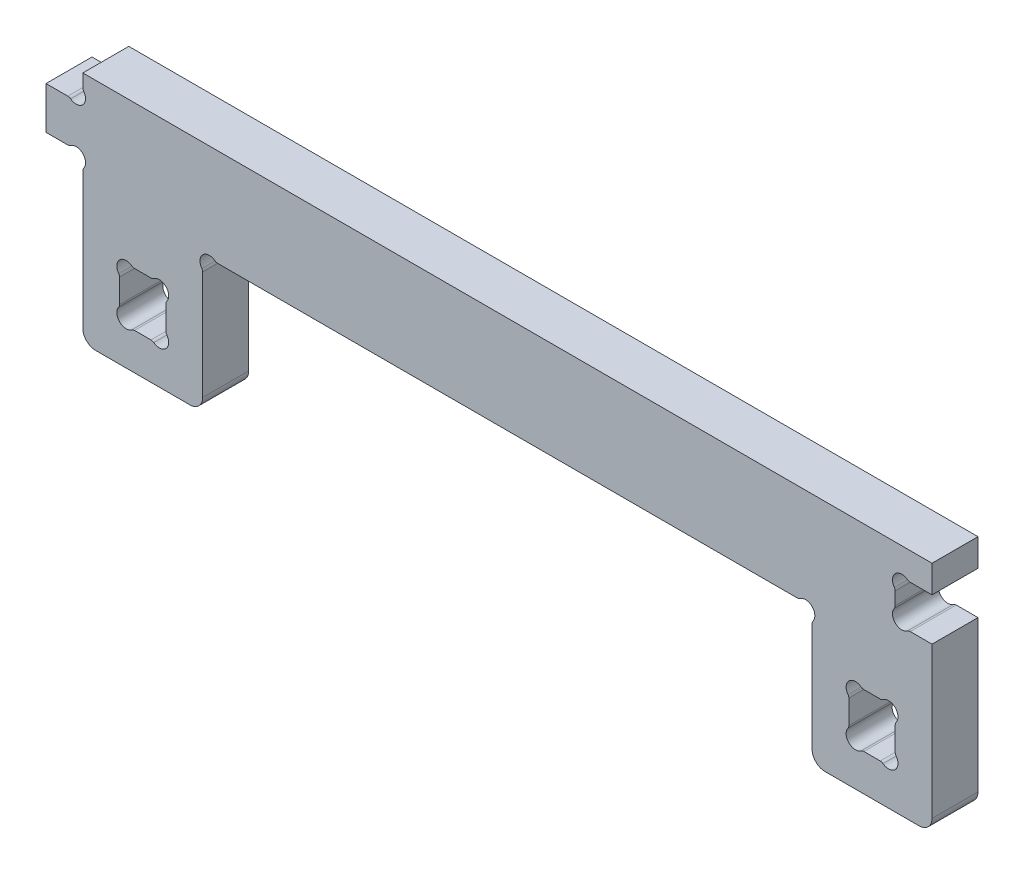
SolidWorks part; units mm, degrees
ref_plane "Plan de face" through (0, 0, 0) normal (0, 0, 1) x (1, 0, 0)
ref_plane "Plan de dessus" through (0, 0, 0) normal (0, 1, 0) x (1, 0, 0)
ref_plane "Plan de droite" through (0, 0, 0) normal (1, 0, 0) x (0, 0, -1)
sketch "Esquisse2" plane through (0, 0, 0) normal (0, 0, 1) x (1, 0, 0)
  line L0 (0, 74.1667) -> (-3.6062, 70.5604) construction
  line L1 (0, 0) -> (65.2, 0)
  line L2 (0, 0) -> (0, 66.0356)
  line L3 (-396.4431, 100.6667) -> (45.2, 100.6667) construction
  line L4 (45.3, 112.1667) -> (45.3, 89.1667) construction
  line L5 (65.2, 89.0667) -> (53.331, 89.0667)
  line L6 (65.2, 112.2667) -> (53.331, 112.2667)
  line L7 (-8.131, 74.1667) -> (-323.112, 74.1667)
  line L8 (-165.6215, 127.1667) -> (-165.6215, 74.1667) construction
  line L9 (-396.4431, 127.1667) -> (65.2, 127.1667)
  line L10 (45.2, 97.1977) -> (45.2, 104.1356)
  line L11 (45.2, 89.0667) -> (48.8062, 92.6729) construction
  line L12 (65.2, 127.1667) -> (65.2, 112.2667)
  line L13 (65.2, 89.0667) -> (65.2, 0)
  line L14 (-331.2431, 0) -> (-331.2431, 66.0356)
  line L15 (-331.2431, 0) -> (-396.4431, 0)
  line L16 (-396.4431, 81.0356) -> (-396.4431, 0)
  line L17 (-404.5741, 89.1667) -> (-416.4431, 89.1667)
  line L18 (-416.4431, 89.1667) -> (-416.4431, 112.1667)
  line L19 (-396.4431, 89.1667) -> (-400.0493, 85.5604) construction
  line L20 (-404.5741, 112.1667) -> (-416.4431, 112.1667)
  line L21 (45.2, 100.6667) -> (65.2, 100.6667) construction
  line L22 (-396.4431, 100.6667) -> (-416.4431, 100.6667) construction
  line L23 (-396.4431, 127.1667) -> (-396.4431, 120.2977)
  line L24 (45.3, 112.1667) -> (65.2, 112.1667) construction
  line L25 (-396.4431, 7) -> (-396.4431, 89.0667) construction
  line L26 (45.3, 89.1667) -> (65.2, 89.1667) construction
  line L28 (32.6, 32.6) -> (32.6, 20) construction
  line L29 (45.2, 41.0356) -> (45.2, 28.131)
  line L30 (28.131, 49.1667) -> (37.069, 49.1667)
  line L31 (20, 34.5833) -> (45.2, 34.5833) construction
  line L32 (20, 41.0356) -> (20, 28.131)
  line L33 (28.131, 20) -> (37.069, 20)
  line L34 (20, 20) -> (32.6, 32.6) construction
  line L35 (-376.4431, 41.0356) -> (-376.4431, 28.131)
  line L36 (-359.3741, 20) -> (-368.312, 20)
  line L37 (-351.2431, 41.0356) -> (-351.2431, 28.131)
  line L38 (-359.3741, 49.1667) -> (-368.312, 49.1667)
  arc A0 (0.4914, 67.524) -> (-6.6426, 74.658) centre (-3.6062, 70.5604) ccw
  arc A1 (0, 66.0356) -> (0.4914, 67.524) centre (2.5, 66.0356) cw
  arc A2 (-6.6426, 74.658) -> (-8.131, 74.1667) centre (-8.131, 76.6667) cw
  arc A3 (44.7086, 95.7093) -> (51.8426, 88.5753) centre (48.8062, 92.6729) ccw
  arc A4 (53.331, 89.0667) -> (51.8426, 88.5753) centre (53.331, 86.5667) ccw
  arc A5 (44.7086, 95.7093) -> (45.2, 97.1977) centre (42.7, 97.1977) ccw
  arc A6 (44.7086, 105.624) -> (45.2, 104.1356) centre (42.7, 104.1356) cw
  arc A7 (44.7086, 105.624) -> (51.8426, 112.758) centre (48.8062, 108.6604) cw
  arc A8 (53.331, 112.2667) -> (51.8426, 112.758) centre (53.331, 114.7667) cw
  arc A9 (-324.6005, 74.658) -> (-323.112, 74.1667) centre (-323.112, 76.6667) ccw
  arc A10 (-331.7344, 67.524) -> (-324.6005, 74.658) centre (-327.6368, 70.5604) cw
  arc A11 (-331.2431, 66.0356) -> (-331.7344, 67.524) centre (-333.7431, 66.0356) ccw
  arc A12 (-395.9517, 82.524) -> (-403.0857, 89.658) centre (-400.0493, 85.5604) ccw
  arc A13 (-404.5741, 89.1667) -> (-403.0857, 89.658) centre (-404.5741, 91.6667) ccw
  arc A14 (-395.9517, 82.524) -> (-396.4431, 81.0356) centre (-393.9431, 81.0356) ccw
  arc A15 (-404.5741, 112.1667) -> (-403.0857, 111.6753) centre (-404.5741, 109.6667) cw
  arc A16 (-395.9517, 118.8093) -> (-403.0857, 111.6753) centre (-400.0493, 115.7729) cw
  arc A17 (-395.9517, 118.8093) -> (-396.4431, 120.2977) centre (-393.9431, 120.2977) cw
  arc A18 (19.5086, 26.6426) -> (26.6426, 19.5086) centre (23.6062, 23.6062) ccw
  arc A19 (19.5086, 26.6426) -> (20, 28.131) centre (17.5, 28.131) ccw
  arc A20 (26.6426, 19.5086) -> (28.131, 20) centre (28.131, 17.5) cw
  arc A21 (38.5574, 19.5086) -> (37.069, 20) centre (37.069, 17.5) ccw
  arc A22 (45.6914, 26.6426) -> (38.5574, 19.5086) centre (41.5938, 23.6062) cw
  arc A23 (45.6914, 26.6426) -> (45.2, 28.131) centre (47.7, 28.131) cw
  arc A24 (45.6914, 42.524) -> (45.2, 41.0356) centre (47.7, 41.0356) ccw
  arc A25 (45.6914, 42.524) -> (38.5574, 49.658) centre (41.5938, 45.5604) ccw
  arc A26 (38.5574, 49.658) -> (37.069, 49.1667) centre (37.069, 51.6667) cw
  arc A27 (26.6426, 49.658) -> (28.131, 49.1667) centre (28.131, 51.6667) ccw
  arc A28 (19.5086, 42.524) -> (26.6426, 49.658) centre (23.6062, 45.5604) cw
  arc A29 (19.5086, 42.524) -> (20, 41.0356) centre (17.5, 41.0356) cw
  arc A30 (-376.9344, 42.524) -> (-376.4431, 41.0356) centre (-378.9431, 41.0356) cw
  arc A31 (-376.9344, 26.6426) -> (-376.4431, 28.131) centre (-378.9431, 28.131) ccw
  arc A32 (-376.9344, 26.6426) -> (-369.8005, 19.5086) centre (-372.8368, 23.6062) ccw
  arc A33 (-369.8005, 19.5086) -> (-368.312, 20) centre (-368.312, 17.5) cw
  arc A34 (-357.8857, 19.5086) -> (-359.3741, 20) centre (-359.3741, 17.5) ccw
  arc A35 (-350.7517, 26.6426) -> (-357.8857, 19.5086) centre (-354.8493, 23.6062) cw
  arc A36 (-350.7517, 26.6426) -> (-351.2431, 28.131) centre (-348.7431, 28.131) cw
  arc A37 (-350.7517, 42.524) -> (-351.2431, 41.0356) centre (-348.7431, 41.0356) ccw
  arc A38 (-350.7517, 42.524) -> (-357.8857, 49.658) centre (-354.8493, 45.5604) ccw
  arc A39 (-357.8857, 49.658) -> (-359.3741, 49.1667) centre (-359.3741, 51.6667) cw
  arc A40 (-369.8005, 49.658) -> (-368.312, 49.1667) centre (-368.312, 51.6667) ccw
  arc A41 (-376.9344, 42.524) -> (-369.8005, 49.658) centre (-372.8368, 45.5604) cw
  point P15 (32.6, 0)
  point P30 (45.2, 96.2792)
  point P49 (-165.6215, 100.6667)
  point P72 (45.3, 100.6667)
  point P92 (32.6, 20)
extrude "Boss.-Extru.2" add sketch "Esquisse2" along normal blind 25
fillet "Congé1" radius 7 4 edges at (0, 0, 12.5) (-331.2431, 0, 12.5) (-396.4431, 0, 12.5) (65.2, 0, 12.5)
equation "\"D1@Boss.-Extru.2\" = \"material_thickness\""
equation "\"D18@Esquisse2\"= \"tool_diameter\" / 2 + \"hole_clearance\""
equation "\"tool_diameter\"=10"
equation "\"hole_clearance\"=0.1"
equation "\"material_thickness\"=25"
equation "\"clearance\"=0.1"
equation "\"outer_slot\"=0.5"
equation "\"fillet\"=7"
equation "\"D7@Esquisse2\"=\"material_thickness\"/10"
equation "\"string\"= 2 * \"tool_diameter\" / 2 * cos ( 45deg )"
equation "\"angle\"= IIF ( \"string\" < \"limit\" , 45 , ( 180 - 2 * arcsin ( \"ThicknessVStool_dia\" ) ) / 2 )"
equation "\"limit\"= \"material_thickness\" / 2 * 5 / 6"
equation "\"ThicknessVStool_dia\"= IIF ( \"limit\" / \"tool_diameter\" > 1 , 1 , \"limit\" / \"tool_diameter\" )"
equation "\"D1@Congé1\"=\"fillet\""
equation "\"D8@Esquisse2\"=\"tool_diameter\" / 2 + \"hole_clearance\""
equation "\"D9@Esquisse2\"=\"material_thickness\"/10"
equation "\"D13@Esquisse2\"=\"tool_diameter\" / 2 + \"hole_clearance\""
equation "\"D14@Esquisse2\"=\"material_thickness\"/10"
equation "\"D18@Esquisse2\"=\"tool_diameter\" / 2 + \"hole_clearance\""
equation "\"D17@Esquisse2\" = \"material_thickness\" / 2 + \"clearance\""
equation "\"D16@Esquisse2\" = \"material_thickness\" / 2"
equation "\"D19@Esquisse2\"=\"material_thickness\"/10"
equation "\"D11@Esquisse2\"=\"angle\""
equation "\"D16@Esquisse2\"= \"material_thickness\" / 2 * 7 / 6"
equation "\"D22@Esquisse2\"=\"material_thickness\""
equation "\"D4@Esquisse2\"=\"clearance\""
equation "\"D10@Esquisse2\"=\"clearance\""
equation "\"D6@Esquisse2\"=\"angle\""
